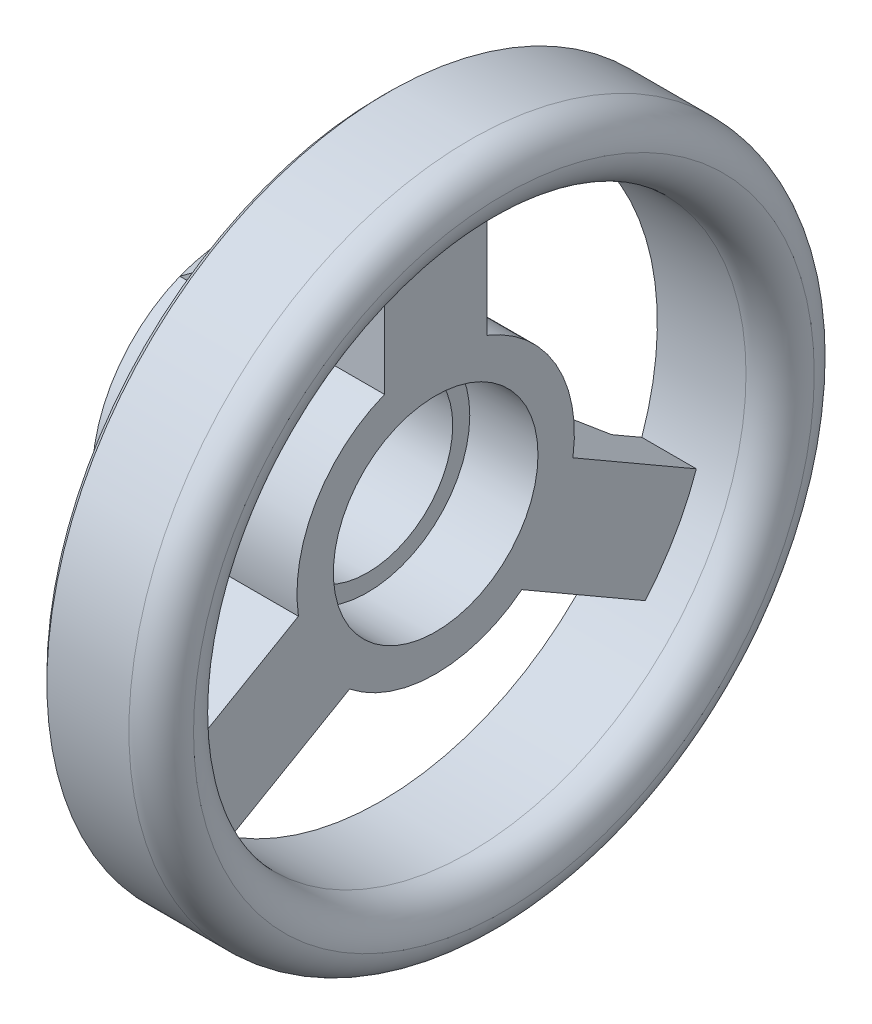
SolidWorks part; units mm, degrees
ref_plane "Vorne" through (0, 0, 0) normal (0, 0, 1) x (1, 0, 0)
ref_plane "Oben" through (0, 0, 0) normal (0, 1, 0) x (1, 0, 0)
ref_plane "Rechts" through (0, 0, 0) normal (1, 0, 0) x (0, 0, -1)
sketch "Skizze1" plane through (0, 0, 0) normal (0, 0, 1) x (1, 0, 0)
  line L0 (0, 2.0337) -> (0, 0)
  line L1 (3, 4.05) -> (4, 4.05)
  line L2 (4, 4.05) -> (4, 5)
  line L3 (4, 5) -> (2.2, 5)
  line L4 (2.2, 5) -> (2.2, 3.55)
  line L5 (-7.8653, 0) -> (49.8134, 0) construction
  line L6 (3, 4.05) -> (3, 0)
  line L7 (0, 2.0337) -> (7.4658, 2.0337) construction
  line L8 (0, 0) -> (3, 0)
  line L9 (2.2, 3.55) -> (0, 2.0337)
  dimension "D2" = 5
  dimension "D1" = 2.0337
  dimension "D3" = 4.05
  dimension "D4" = 1.8
  dimension "D5" = 1
  dimension "D6" = 4
  dimension "D7" = 1.45
revolve "Rotation1" add sketch "Skizze1" angle 360 about L8
fillet "Verrundung1" radius 0.5 1 edges at (4, 0, 4.05)
fillet "Verrundung2" radius 0.5 1 edges at (4, 0, 5)
sketch "Skizze2" plane through (0, 0, 0) normal (-1, 0, 0) x (0, 0, 1)
  circle A0 centre (0, 0) radius 1.25
extrude "Schnitt-Linear austragen1" cut sketch "Skizze2" against normal through all
sketch "Skizze3" plane through (3, 0, 0) normal (1, 0, 0) x (0, 0, -1)
  circle A0 centre (0, 0) radius 1.5
extrude "Schnitt-Linear austragen2" cut sketch "Skizze3" against normal blind 1
sketch "Skizze4" plane through (3, 0, 0) normal (1, 0, 0) x (0, 0, -1)
  line L0 (-0.75, 3.9799) -> (-0.75, 1.8904)
  line L1 (0.75, 3.9799) -> (0.75, 1.8904)
  line L2 (-3.8217, -1.3405) -> (-2.0121, -0.2957)
  line L3 (-3.0717, -2.6395) -> (-1.2621, -1.5947)
  line L4 (0, 0) -> (-7.2223, -4.1698) construction
  line L5 (0, 0) -> (0, 5.9471) construction
  line L6 (0, 0) -> (6.3143, -3.6456) construction
  line L7 (3.8217, -1.3405) -> (2.0121, -0.2957)
  line L8 (3.0717, -2.6395) -> (1.2621, -1.5947)
  circle A0 centre (0, 0) radius 4.05 construction
  circle A1 centre (0, 0) radius 2.0337 construction
  arc A2 (-0.75, 1.8904) -> (-2.0121, -0.2957) centre (0, 0) ccw
  arc A3 (-0.75, 3.9799) -> (-3.8217, -1.3405) centre (0, 0) ccw
  arc A4 (0.75, 3.9799) -> (3.8217, -1.3405) centre (0, 0) cw
  arc A5 (0.75, 1.8904) -> (2.0121, -0.2957) centre (0, 0) cw
  arc A6 (1.2621, -1.5947) -> (-1.2621, -1.5947) centre (0, 0) cw
  arc A7 (-3.0717, -2.6395) -> (3.0717, -2.6395) centre (0, 0) ccw
  dimension "D1" = 1.5
  dimension "D2" = 0.75
  dimension "D3" = 1.5
  dimension "D4" = 1.5
  dimension "D5" = 120
  dimension "D6" = 120
  dimension "D7" = 0.75
  dimension "D8" = 0.75
extrude "Schnitt-Linear austragen3" cut sketch "Skizze4" against normal through all and the other way through all
chamfer "Fase1" distance 0.1 angle 45 1 edges at (2.2, 0, 5)
